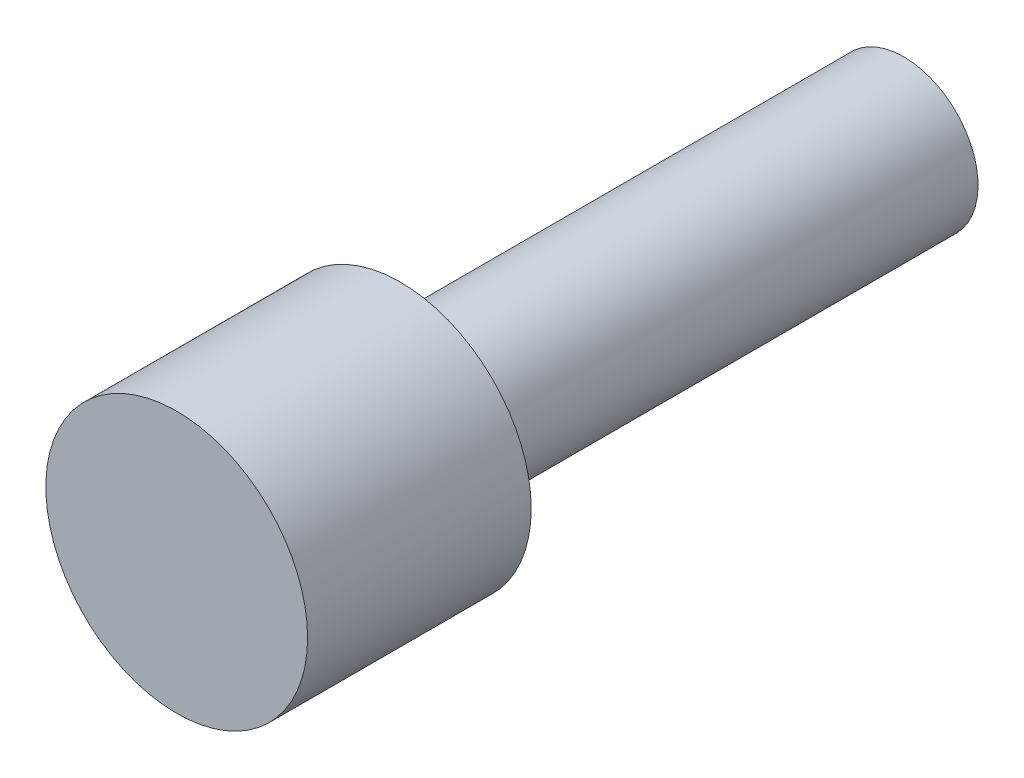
SolidWorks part; units mm, degrees
ref_plane "Front Plane" through (0, 0, 0) normal (0, 0, 1) x (1, 0, 0)
ref_plane "Top Plane" through (0, 0, 0) normal (0, 1, 0) x (1, 0, 0)
ref_plane "Right Plane" through (0, 0, 0) normal (1, 0, 0) x (0, 0, -1)
sketch "Sketch1" plane through (0, 0, 0) normal (0, 0, 1) x (1, 0, 0)
  circle A0 centre (0, 0) radius 7.2 construction
  circle A1 centre (0, 0) radius 7.2
extrude "Boss-Extrude1" add sketch "Sketch1" against normal up to vertex (12.3 mm away)
sketch "Sketch2" plane through (0, 0, -12.3) normal (0, 0, -1) x (-1, 0, 0)
  circle A0 centre (0, 0) radius 4.08
  dimension "D1" = 8.16
extrude "Boss-Extrude2" add sketch "Sketch2" along normal up to surface (27.7 mm away)
